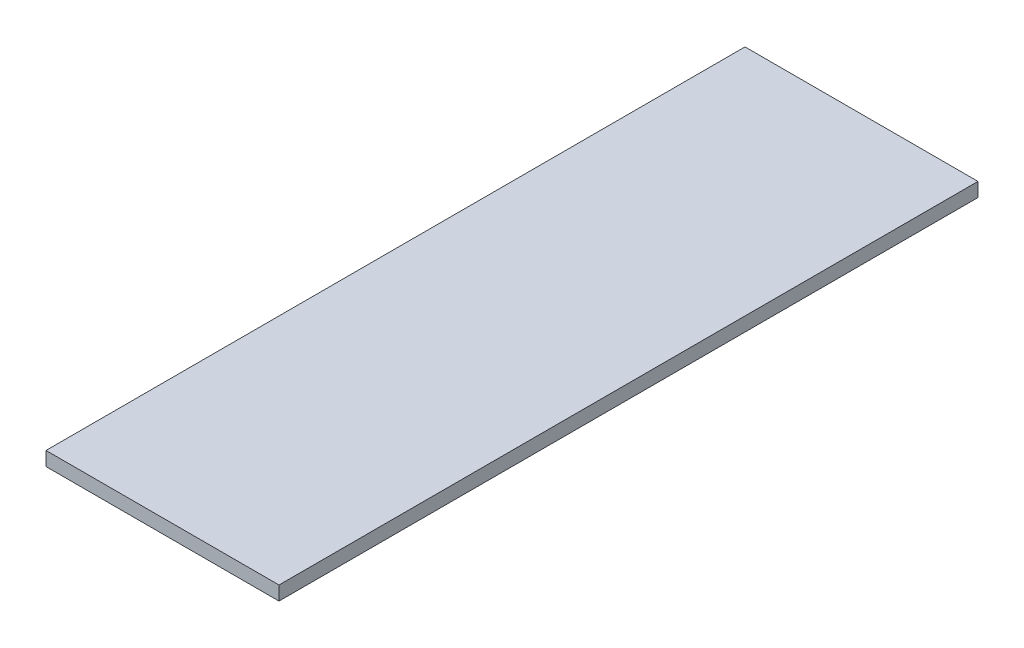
SolidWorks part; units mm, degrees
ref_plane "Plan de face" through (0, 0, 0) normal (0, 0, 1) x (1, 0, 0)
ref_plane "Plan de dessus" through (0, 0, 0) normal (0, 1, 0) x (1, 0, 0)
ref_plane "Plan de droite" through (0, 0, 0) normal (1, 0, 0) x (0, 0, -1)
sketch "Esquisse1" plane through (0, 0, 0) normal (0, 1, 0) x (1, 0, 0)
  line L1 (25, -75) -> (-25, -75)
  line L2 (25, -75) -> (25, 75)
  line L3 (25, 75) -> (-25, 75)
  line L4 (-25, -75) -> (-25, 75)
  line L5 (25, -75) -> (-25, 75) construction
  line L6 (25, 75) -> (-25, -75) construction
  point P0 (0, 0)
  dimension "D1" = 150
  dimension "D2" = 50
extrude "Boss.-Extru.1" add sketch "Esquisse1" along normal blind 3
